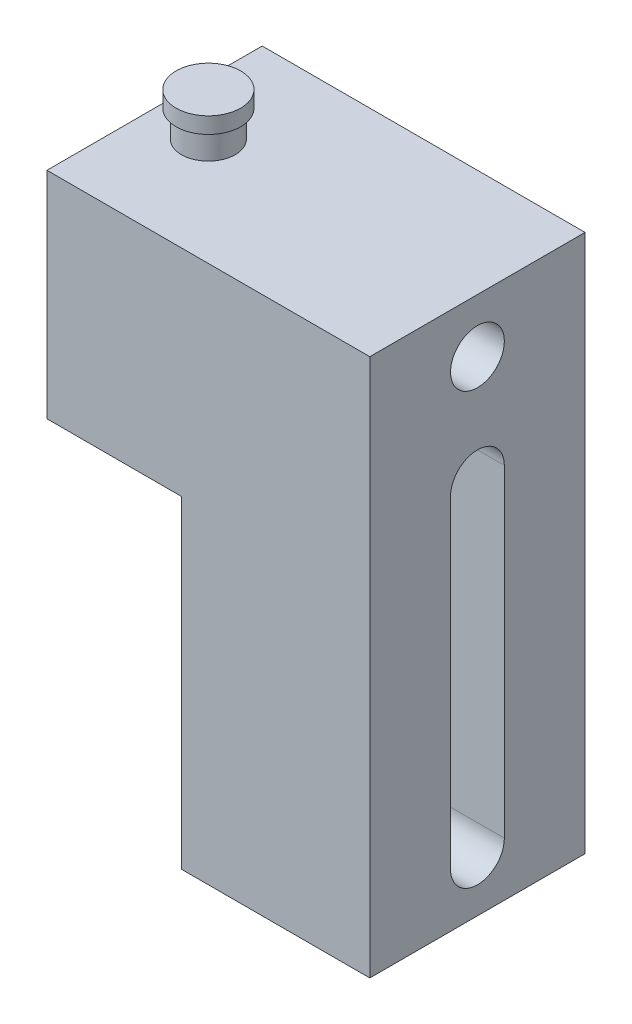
SolidWorks part; units mm, degrees
ref_plane "Face" through (0, 0, 0) normal (0, 0, 1) x (1, 0, 0)
ref_plane "Dessus" through (0, 0, 0) normal (0, 1, 0) x (1, 0, 0)
ref_plane "Droite" through (0, 0, 0) normal (1, 0, 0) x (0, 0, -1)
sketch "Esquisse1" plane through (0, 0, 0) normal (0, 0, 1) x (1, 0, 0)
  line L0 (0, 0) -> (60, 0)
  line L1 (60, 0) -> (60, -100)
  line L2 (60, -100) -> (25, -100)
  line L3 (25, -100) -> (25, -40)
  line L4 (25, -40) -> (0, -40)
  line L5 (0, -40) -> (0, 0)
  dimension "D1" = 60
  dimension "D2" = 40
  dimension "D3" = 35
  dimension "D4" = 100
extrude "Base-Extrusion" add sketch "Esquisse1" along normal blind 40
sketch "Esquisse2" plane through (0, 0, 0) normal (0, 1, 0) x (-1, 0, 0)
  line L0 (0, 20) -> (-33.6316, 20) construction
  line L1 (0, 40) -> (0, 0) construction
  circle A0 centre (-10, 20) radius 5
  dimension "D1" = 10
  dimension "D2" = 10
extrude "Boss.-Extru.1" add sketch "Esquisse2" along normal blind 5
sketch "Esquisse3" plane through (0, 5, 0) normal (0, 1, 0) x (-1, 0, 0)
  circle A0 centre (-10, 20) radius 5 construction
  point P0 (-10, 20)
ref_plane "Plan1" through (10, 0, 0) normal (1, 0, 0) x (0, 0, -1)
sketch "Esquisse5" plane through (60, 0, 0) normal (1, 0, 0) x (0, 0, -1)
  line L0 (-20, 0) -> (-20, -99.5112) construction
  line L1 (-20, 5) -> (-20, 0) construction
  line L2 (-40, 0) -> (0, 0) construction
  circle A0 centre (-20, -10) radius 5
  dimension "D1" = 10
  dimension "D2" = 10
extrude "Enlèv. mat.-Extru.1" cut sketch "Esquisse5" against normal blind 10
sketch "Esquisse6" plane through (60, 0, 0) normal (1, 0, 0) x (0, 0, -1)
  line L0 (-20, -99.7412) -> (-20, -40.2761) construction
  line L1 (-20, 5) -> (-20, 0) construction
  line L2 (-40, -100) -> (0, -100) construction
  line L4 (-25, -90) -> (-25, -30)
  line L6 (-15, -90) -> (-15, -30)
  arc A0 (-25, -90) -> (-15, -90) centre (-20, -90) ccw
  arc A1 (-25, -30) -> (-15, -30) centre (-20, -30) cw
  dimension "D1" = 5
  dimension "D2" = 60
  dimension "D3" = 10
extrude "Enlèv. mat.-Extru.2" cut sketch "Esquisse6" against normal blind 20
sketch "Esquisse7" plane through (0, 5, 0) normal (0, 1, 0) x (-1, 0, 0)
  circle A0 centre (-10, 20) radius 6
  circle A1 centre (-10, 20) radius 5 construction
  dimension "D1" = 12
extrude "Boss.-Extru.2" add sketch "Esquisse7" along normal blind 3
